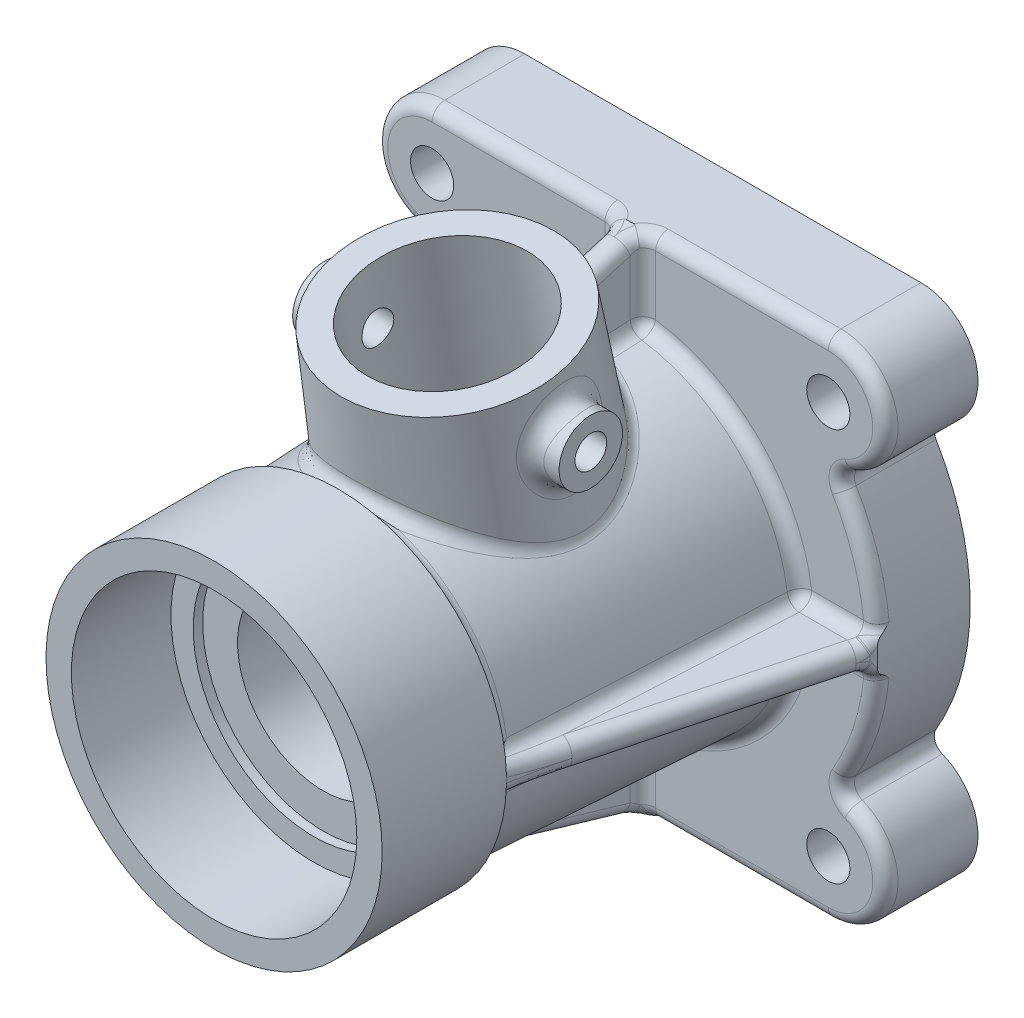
SolidWorks part; units mm, degrees
ref_plane "Plan1" through (0, 0, 0) normal (0, 0, 1) x (1, 0, 0)
ref_plane "Plan2" through (0, 0, 0) normal (0, 1, 0) x (1, 0, 0)
ref_plane "Plan3" through (0, 0, 0) normal (1, 0, 0) x (0, 0, -1)
sketch "Esquisse1" plane through (0, 0, 0) normal (0, 0, 1) x (1, 0, 0)
  line L0 (0, 24.7958) -> (0, -28.468) construction
  line L1 (15.6125, 20) -> (-15.6125, 20)
  line L2 (-15.6125, -20) -> (15.6125, -20)
  arc A0 (-16.8053, -9.891) -> (-16.8053, 9.891) centre (0, 0) cw
  arc A1 (17.2936, 11.3258) -> (15.6125, 20) centre (15.6125, 15.5) ccw
  arc A2 (-16.8053, -9.891) -> (-17.2936, -11.3258) centre (-17.6671, -10.3982) cw
  arc A3 (17.2936, 11.3258) -> (16.8053, 9.891) centre (17.6671, 10.3982) ccw
  arc A4 (-15.6125, -20) -> (-17.2936, -11.3258) centre (-15.6125, -15.5) cw
  arc A5 (-17.2936, 11.3258) -> (-16.8053, 9.891) centre (-17.6671, 10.3982) cw
  arc A6 (-17.2936, 11.3258) -> (-15.6125, 20) centre (-15.6125, 15.5) cw
  arc A7 (15.6125, -20) -> (17.2936, -11.3258) centre (15.6125, -15.5) ccw
  arc A8 (16.8053, -9.891) -> (17.2936, -11.3258) centre (17.6671, -10.3982) ccw
  arc A9 (16.8053, -9.891) -> (16.8053, 9.891) centre (0, 0) ccw
  point P27 (0, 20)
  dimension "D1" = 4.5
  dimension "D2" = 19.5
  dimension "D3" = 4.5
  dimension "D4" = 1
  dimension "D5" = 1
  dimension "D14" = 15.5
  dimension "D15" = 15.6125
  dimension "D6" = 20
  dimension "D8" = 15.6125
  dimension "D9" = 15.5
  dimension "D10" = 17.6671
  dimension "D11" = 10.3982
  dimension "D12" = 17.6671
  dimension "D13" = 10.3982
extrude "Base-Extrusion" add sketch "Esquisse1" along normal blind 7.3
sketch "Esquisse2" plane through (0, 0, 7.3) normal (0, 0, 1) x (1, 0, 0)
  circle A0 centre (0, 0) radius 13.5
  arc A1 (16.8053, -9.891) -> (16.8053, 9.891) centre (0, 0) ccw construction
  dimension "D1" = 27
extrude "Boss.-Extru.1" add sketch "Esquisse2" along normal blind 23 draft 3
sketch "Esquisse3" plane through (0, 0, 30.3) normal (0, 0, 1) x (1, 0, 0)
  circle A0 centre (0, 0) radius 13.25
  circle A1 centre (0, 0) radius 12.2946 construction
  dimension "D1" = 26.5
extrude "Boss.-Extru.2" add sketch "Esquisse3" along normal blind 9.8
ref_plane "Plan4" through (0, 0, 19.3) normal (0, 0, 1) x (1, 0, 0)
sketch "Esquisse5" plane through (0, 0, 19.3) normal (0, 0, 1) x (1, 0, 0)
  line L0 (-36.9, 7.25) -> (12.6, 7.25) construction
  dimension "D1" = 7.25
ref_plane "Plan5" through (0, 10.3319, 1.8218) normal (0, -0.9848, -0.1736) x (1, 0, 0)
sketch "Esquisse6" plane through (0, 10.3319, 1.8218) normal (0, -0.9848, -0.1736) x (1, 0, 0)
  line L0 (-36.9, 17.7478) -> (12.6, 17.7478) construction
  circle A0 centre (0, 17.7478) radius 9
  dimension "D1" = 18
extrude "Boss.-Extru.3" add sketch "Esquisse6" against normal blind 13.9 draft 2
sketch "Esquisse7" plane through (0, 0, 0) normal (1, 0, 0) x (0, 0, -1)
  line L0 (-30.3, -13.25) -> (-7.3, -20)
  line L1 (-40.1, -13.25) -> (-30.3, -13.25) construction
rib "Nervure3" sketch "Esquisse7" sketch "Esquisse7" thickness 2 extrusion direction parallel to sketch draft on no parameters "D1"=2
sketch "Esquisse8" plane through (0, 0, 0) normal (1, 0, 0) x (0, 0, -1)
  line L6 (-12.096, 18.5801) -> (-7.3, 20)
rib "Nervure4" sketch "Esquisse8" sketch "Esquisse8" thickness 2 extrusion direction parallel to sketch draft on no parameters "D1"=2
sketch "Esquisse10" plane through (0, 0, 0) normal (1, 0, 0) x (0, 0, -1)
  line L0 (0, 16.5) -> (-4.75, 16.5)
  line L1 (0, 11.3258) -> (0, 20) construction
  line L2 (-4.75, 16.5) -> (-4.75, 14.5)
  line L3 (-4.75, 14.5) -> (-5.5, 14.5)
  line L4 (-5.5, 14.5) -> (-5.5, 6.75)
  line L5 (-5.5, 6.75) -> (-31.5, 6.75)
  line L6 (-31.5, 6.75) -> (-31.5, 9.5)
  line L7 (-31.5, 9.5) -> (-32.25, 9.5)
  line L8 (-32.25, 9.5) -> (-32.25, 11.25)
  line L9 (-32.25, 11.25) -> (-40.1, 11.25)
  line L10 (-40.1, 13.25) -> (-40.1, -13.25) construction
  line L11 (0, 16.5) -> (0, 0)
  line L12 (0, 0) -> (-40.1, 0)
  line L14 (-40.1, 11.25) -> (-40.1, 0)
  line L15 (-49.0413, 0) -> (18.6971, 0) construction
  line L16 (-7.3, 0) -> (0, 0) construction
  dimension "D1" = 16.5
  dimension "D2" = 4.75
  dimension "D3" = 0.75
  dimension "D4" = 14.5
  dimension "D5" = 6.75
  dimension "D6" = 26
  dimension "D7" = 9.5
  dimension "D8" = 0.75
  dimension "D9" = 11.25
revolve "Enlèvement de matière-Révolution1" cut sketch "Esquisse10" angle 360 about L15
sketch "Esquisse17" plane through (0, 0, 0) normal (0, 1, 0) x (1, 0, 0)
  line L0 (19.4, -7.3) -> (13.25, -30.3)
  line L3 (16.8053, -7.3) -> (19.5, -7.3) construction
  line L4 (13.25, -30.3) -> (-13.25, -30.3) construction
rib "Nervure19" sketch "Esquisse17" sketch "Esquisse17" thickness 2 extrusion direction parallel to sketch draft on no parameters "D1"=2
sketch "Esquisse18" plane through (0, 0, 0) normal (0, 1, 0) x (1, 0, 0)
  line L0 (-19.4, -7.3) -> (-13.25, -30.3)
  line L4 (-19.5, -7.3) -> (-16.8053, -7.3) construction
rib "Nervure21" sketch "Esquisse18" sketch "Esquisse18" thickness 2 extrusion direction parallel to sketch draft on no parameters "D1"=2
fillet "Congé6" radius 1
fillet "Congé7" radius 1
fillet "Congé8" radius 1
fillet "Congé10" radius 1
fillet "Congé11" radius 1
fillet "Congé12" radius 1
sketch "Esquisse11" plane through (0, 24.0207, 4.2355) normal (0, 0.9848, 0.1736) x (-1, 0, 0)
  circle A0 centre (0, 17.7478) radius 6.4
  circle A1 centre (0, 17.7478) radius 8.5146 construction
  dimension "D1" = 12.8
extrude "Enlèv. mat.-Extru.1" cut sketch "Esquisse11" against normal blind 12.5
sketch "Esquisse12" plane through (0, 11.7106, 2.0649) normal (0, 0.9848, 0.1736) x (-1, 0, 0)
  circle A0 centre (0, 17.7478) radius 5.91
  circle A1 centre (0, 17.7478) radius 6.4 construction
  dimension "D1" = 11.82
extrude "Enlèv. mat.-Extru.2" cut sketch "Esquisse12" against normal up to next
hole_wizard "Perçage1" positions "Esquisse14" profile "Esquisse13" hole size "M3" standard "ISO"
sketch "Esquisse14" plane through (0, 0, 0) normal (0, 0, -1) x (-1, 0, 0)
  arc A0 (-15.6125, 20) -> (-17.2936, 11.3258) centre (-15.6125, 15.5) ccw construction
  arc A1 (17.2936, 11.3258) -> (15.6125, 20) centre (15.6125, 15.5) ccw construction
  arc A2 (15.6125, -20) -> (17.2936, -11.3258) centre (15.6125, -15.5) ccw construction
  arc A3 (-17.2936, -11.3258) -> (-15.6125, -20) centre (-15.6125, -15.5) ccw construction
  point P0 (15.6125, 15.5)
  point P1 (-15.6125, 15.5)
  point P2 (-15.6125, -15.5)
  point P3 (15.6125, -15.5)
sketch "Esquisse13" plane through (-15.6125, 15.5, 0) normal (1, 0, 0) x (0, 1, 0)
  line L0 (0, 0) -> (0, 40.1)
  line L1 (0, 40.1) -> (1.7, 40.1)
  line L2 (1.7, 40.1) -> (1.7, 0)
  line L5 (1.7, 0) -> (0, 0)
  line L11 (0, -6.35) -> (0, 107.95) construction
  dimension "Diamètre du perçage jusqu'au prochain" = 3.4
  dimension "Profondeur du perçage jusqu'au prochain" = 40.1
fillet "Congé48" radius 1
fillet "Congé51" radius 1
fillet "Congé52" radius 1
fillet "Congé54" radius 1
fillet "Congé57" radius 1
fillet "Congé60" radius 1
fillet "Congé61" radius 1
fillet "Congé68" radius 1
fillet "Congé69" radius 1
fillet "Congé70" radius 1
fillet "Congé71" radius 1
fillet "Congé73" radius 1
fillet "Congé74" radius 1
fillet "Congé75" radius 1
fillet "Congé76" radius 1
fillet "Congé77" radius 1
fillet "Congé78" radius 1
fillet "Congé79" radius 1
fillet "Congé80" radius 1
fillet "Congé81" radius 1
fillet "Congé82" radius 1
fillet "Congé83" radius 1
ref_plane "Plan6" through (0, 19.4414, 3.428) normal (0, 0.9848, 0.1736) x (-1, 0, 0)
sketch "Esquisse19" plane through (0, 19.4414, 3.428) normal (0, 0.9848, 0.1736) x (-1, 0, 0)
  line L0 (0, 15.4) -> (0, 29.3936) construction
  line L1 (0, 8.1224) -> (0, 28.8081) construction
  line L2 (10.5, 15.2478) -> (7, 15.2478)
  line L3 (-10.5, 15.2478) -> (-7, 15.2478)
  line L4 (7, 15.2478) -> (7, 17.7478)
  line L5 (-7, 15.2478) -> (-7, 17.7478)
  line L6 (7, 17.7478) -> (10.5, 17.7478)
  line L7 (-7, 17.7478) -> (-10.5, 17.7478)
  line L8 (10.5, 17.7478) -> (10.5, 15.2478)
  line L9 (-10.5, 17.7478) -> (-10.5, 15.2478)
  line L10 (-11.8439, 17.7478) -> (13.1046, 17.7478) construction
  line L11 (11.8439, 17.7478) -> (-13.1046, 17.7478) construction
  dimension "D1" = 2.5
  dimension "D2" = 10.5
revolve "Boss.-Révol.1" add sketch "Esquisse19" angle 360 about L10
hole_wizard "Perçage2" positions "Esquisse22" profile "Esquisse21" tap size "M3x0.5" standard "ISO"
sketch "Esquisse22" plane through (10.5, 0, 0) normal (1, 0, 0) x (0, 0, -1)
  circle A0 centre (-20.9062, 16.3595) radius 2.5 construction
  point P0 (-20.9062, 16.3595)
  point P3 (-0.7, -10.6)
sketch "Esquisse21" plane through (10.5, 16.3595, 20.9062) normal (0, 1, 0) x (0, 0, -1)
  line L0 (0, 0) -> (0, 4.1)
  line L1 (0, 4.1) -> (1.25, 4.1)
  line L2 (1.25, 4.1) -> (1.25, 0)
  line L5 (1.25, 0) -> (0, 0)
  line L11 (0, -6.35) -> (0, 107.95) construction
  dimension "Diamètre du perçage jusqu'au prochain" = 2.5
  dimension "Profondeur du perçage jusqu'au prochain" = 4.1
fillet "Congé84" radius 1.4
chamfer "Chanfrein1" distance 1.75 angle 45
hole_wizard "Perçage3" positions "Esquisse24" profile "Esquisse23" tap size "M3x0.5" standard "ISO"
sketch "Esquisse24" plane through (-10.5, 0, 0) normal (-1, 0, 0) x (0, 0, 1)
  circle A0 centre (20.9062, 16.3595) radius 2.5 construction
  point P0 (20.9062, 16.3595)
sketch "Esquisse23" plane through (-10.5, 16.3595, 20.9062) normal (0, 1, 0) x (0, 0, 1)
  line L0 (0, 0) -> (0, 4.1)
  line L1 (0, 4.1) -> (1.25, 4.1)
  line L2 (1.25, 4.1) -> (1.25, 0)
  line L5 (1.25, 0) -> (0, 0)
  line L11 (0, -6.35) -> (0, 107.95) construction
  dimension "Diamètre du perçage jusqu'au prochain" = 2.5
  dimension "Profondeur du perçage jusqu'au prochain" = 4.1
sketch "Esquisse25" plane through (0, 0, 0) normal (0, 0, -1) x (-1, 0, 0)
  line L1 (0, 24.3) -> (27.3, 24.3)
  line L2 (0, 24.3) -> (0, -22.5)
  line L3 (0, -22.5) -> (27.3, -22.5)
  line L4 (27.3, 24.3) -> (27.3, -22.5)
extrude "Enlèv. mat.-Extru.3" [suppressed] cut sketch "Esquisse25" against normal through all
